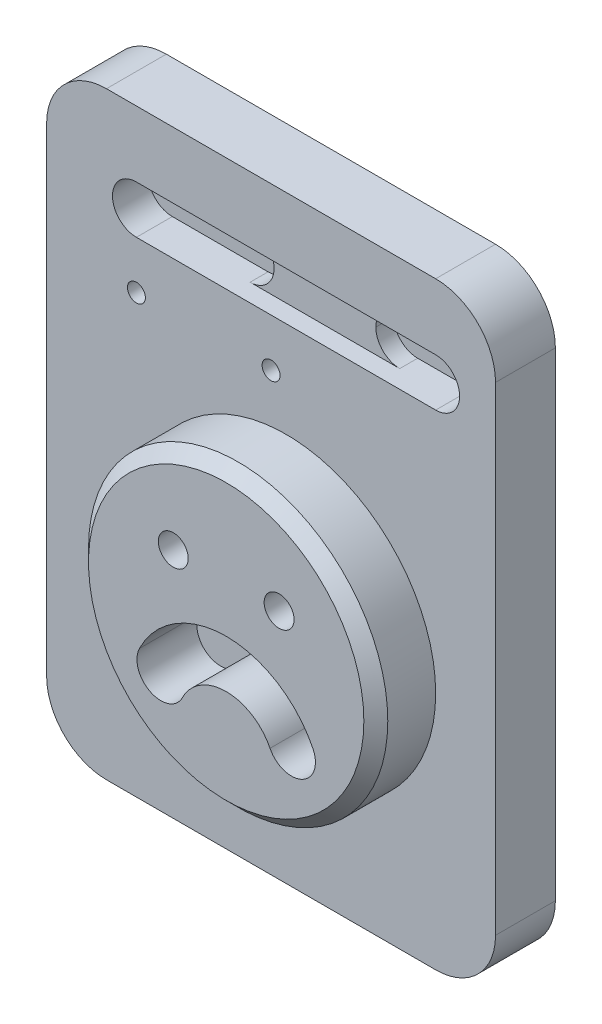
SolidWorks part; units mm, degrees
ref_plane "Front Plane" through (0, 0, 0) normal (0, 0, 1) x (1, 0, 0)
ref_plane "Top Plane" through (0, 0, 0) normal (0, 1, 0) x (1, 0, 0)
ref_plane "Right Plane" through (0, 0, 0) normal (1, 0, 0) x (0, 0, -1)
sketch "Sketch2" plane through (0, 0, 0) normal (0, 0, 1) x (1, 0, 0)
  line L1 (0, 0) -> (75, 0)
  line L2 (0, 0) -> (0, 100)
  line L3 (0, 100) -> (75, 100)
  line L4 (75, 0) -> (75, 100)
  dimension "D1" = 75
  dimension "D2" = 100
extrude "Boss-Extrude1" add sketch "Sketch2" along normal blind 10
sketch "Sketch5" plane through (0, 0, 10) normal (0, 0, 1) x (1, 0, 0)
  line L0 (75, 0) -> (75, 100) construction
  line L1 (0, 0) -> (75, 0) construction
  line L2 (40, 65) -> (40, 15) construction
  arc A0 (25.2222, 60.1647) -> (54.7778, 60.1647) centre (40, 40) ccw
  arc A5 (48.8515, 63.3806) -> (31.1485, 63.3806) centre (40, 40) ccw
  arc A6 (31.1485, 63.3806) -> (25.2222, 60.1647) centre (40, 40) ccw
  arc A7 (48.8515, 63.3806) -> (54.7778, 60.1647) centre (40, 40) cw
  dimension "D1" = 50
  dimension "D2" = 35
  dimension "D3" = 40
extrude "Boss-Extrude4" add sketch "Sketch5" along normal blind 10
sketch "Sketch6" plane through (0, 0, 20) normal (0, 0, 1) x (1, 0, 0)
  line L0 (15, 40) -> (65, 40) construction
  line L1 (40, 65) -> (40, 15) construction
  line L2 (40, 40) -> (22.3223, 57.6777) construction
  line L3 (40, 40) -> (57.6777, 57.6777)
  circle A0 centre (40, 40) radius 25 construction
  circle A1 centre (40, 40) radius 25 construction
  point P11 (31.1612, 48.8388)
  point P13 (40, 35)
  point P14 (48.8388, 48.8388)
  dimension "D1" = 45
  dimension "D2" = 45
  dimension "D3" = 5
hole_wizard "Ø5.0 (5) Diameter Hole1" positions "Sketch7" profile "Sketch8" hole size "Ø5.0" standard "AS"
sketch "Sketch7" plane through (0, 0, 20) normal (0, 0, 1) x (1, 0, 0)
  point P0 (31.1612, 48.8388)
  point P3 (48.8388, 48.8388)
sketch "Sketch8" plane through (31.1612, 48.8388, 20) normal (1, 0, 0) x (0, -1, 0)
  line L0 (0, 0) -> (0, 20)
  line L1 (0, 20) -> (2.5, 20)
  line L2 (2.5, 20) -> (2.5, 0)
  line L5 (2.5, 0) -> (0, 0)
  line L11 (0, -6.35) -> (0, 107.95) construction
  dimension "Thru Hole Dia." = 5
  dimension "Thru Hole Depth" = 20
sketch "Sketch12" plane through (0, 0, 10) normal (0, 0, 1) x (1, 0, 0)
  line L0 (15, 85) -> (65, 85) construction
  line L1 (15, 89) -> (65, 89)
  line L2 (15, 81) -> (65, 81)
  line L3 (75, 100) -> (0, 100) construction
  line L4 (40, 65) -> (40, 96.7105) construction
  arc A0 (15, 89) -> (15, 81) centre (15, 85) ccw
  arc A1 (65, 81) -> (65, 89) centre (65, 85) ccw
  point P2 (40, 85)
  dimension "D1" = 15
  dimension "D2" = 8
  dimension "D3" = 50
extrude "Cut-Extrude1" cut sketch "Sketch12" against normal blind 6
fillet "Fillet1" radius 10 4 edges at (0, 0, 5) (75, 0, 5) (75, 100, 5) (0, 100, 5)
sketch "Sketch13" plane through (0, 0, 10) normal (0, 0, 1) x (1, 0, 0)
  line L0 (0, 73) -> (75, 73) construction
  line L1 (0, 90) -> (0, 10) construction
  line L2 (75, 10) -> (75, 90) construction
  line L3 (65, 100) -> (10, 100) construction
  point P8 (15, 73)
  point P9 (60, 73)
  point P10 (37.5, 73)
  dimension "D1" = 27
  dimension "D2" = 15
  dimension "D3" = 15
hole_wizard "Ø3.0 (3) Diameter Hole1" positions "Sketch14" profile "Sketch15" hole size "Ø3.0" standard "AS"
sketch "Sketch14" plane through (0, 0, 10) normal (0, 0, 1) x (1, 0, 0)
  line L0 (0, 73) -> (75, 73) construction
  point P0 (15, 73)
  point P3 (37.5, 73)
sketch "Sketch15" plane through (15, 73, 10) normal (1, 0, 0) x (0, -1, 0)
  line L0 (0, 0) -> (0, 10.9013)
  line L1 (0, 10.9013) -> (1.5, 10)
  line L2 (1.5, 10) -> (1.5, 0)
  line L5 (1.5, 0) -> (0, 0)
  line L10 (0, 10.9013) -> (-1.5, 10) construction
  line L11 (0, -6.35) -> (0, 107.95) construction
  dimension "Hole Dia." = 3
  dimension "Hole Depth" = 10
  dimension "Drill Angle" = 118
sketch "Sketch18" plane through (0, 0, 4) normal (0, 0, 1) x (1, 0, 0)
  line L0 (40, 89) -> (40, 81) construction
  line L1 (65, 89) -> (15, 89) construction
  line L2 (15, 81) -> (65, 81) construction
  line L4 (35, 89) -> (52, 89)
  line L5 (35, 89) -> (35, 81)
  line L6 (35, 81) -> (52, 81)
  line L7 (52, 89) -> (52, 81)
  dimension "D1" = 5
  dimension "D2" = 12
extrude "Boss-Extrude5" add sketch "Sketch18" along normal blind 3
fillet "Fillet2" radius 4 4 edges at (52, 81, 5.5) (52, 89, 5.5) (35, 81, 5.5) (35, 89, 5.5)
sketch "Sketch19" plane through (0, 0, 10) normal (0, 0, 1) x (1, 0, 0)
  line L0 (12.5994, 7.3232) -> (65.2612, 7.3232) construction
  text T0 "YAY                    NAY"
sketch "Sketch20" plane through (0, 0, 20) normal (0, 0, 1) x (1, 0, 0)
  line L0 (40, 65) -> (40, 15) construction
  line L1 (29.0891, 29.9881) -> (50.9109, 29.9881) construction
  arc A0 (29.0891, 29.9881) -> (50.9109, 29.9881) centre (40, 24.6091) cw construction
  arc A1 (54.4986, 31.7568) -> (25.5014, 31.7568) centre (40, 24.6091) ccw
  arc A2 (47.3232, 28.2194) -> (32.6768, 28.2194) centre (40, 24.6091) ccw
  arc A3 (47.3232, 28.2194) -> (54.4986, 31.7568) centre (50.9109, 29.9881) ccw
  arc A4 (25.5014, 31.7568) -> (32.6768, 28.2194) centre (29.0891, 29.9881) ccw
  circle A5 centre (40, 40) radius 25 construction
  circle A6 centre (40, 40) radius 25 construction
  point P3 (40, 36.7739)
  point P8 (29.3924, 29.5712)
  point P18 (40, 21.0262)
  point P19 (26.0457, 29.7136)
  point P20 (40, 19.4784)
  point P21 (40, 36.1118)
  point P22 (30.0718, 29.6571)
  point P23 (40, 37.5186)
  point P24 (26.0996, 29.9881)
  point P25 (0, 0)
  point P26 (40, 17.0785)
  point P27 (40, 36.8566)
  point P28 (40, 24.6091)
  point P29 (40, 36.7739)
  dimension "D1" = 4
extrude "Cut-Extrude2" cut sketch "Sketch20" against normal blind 10
chamfer "Chamfer1" distance 2 angle 45 1 edges at (65, 40, 20)
